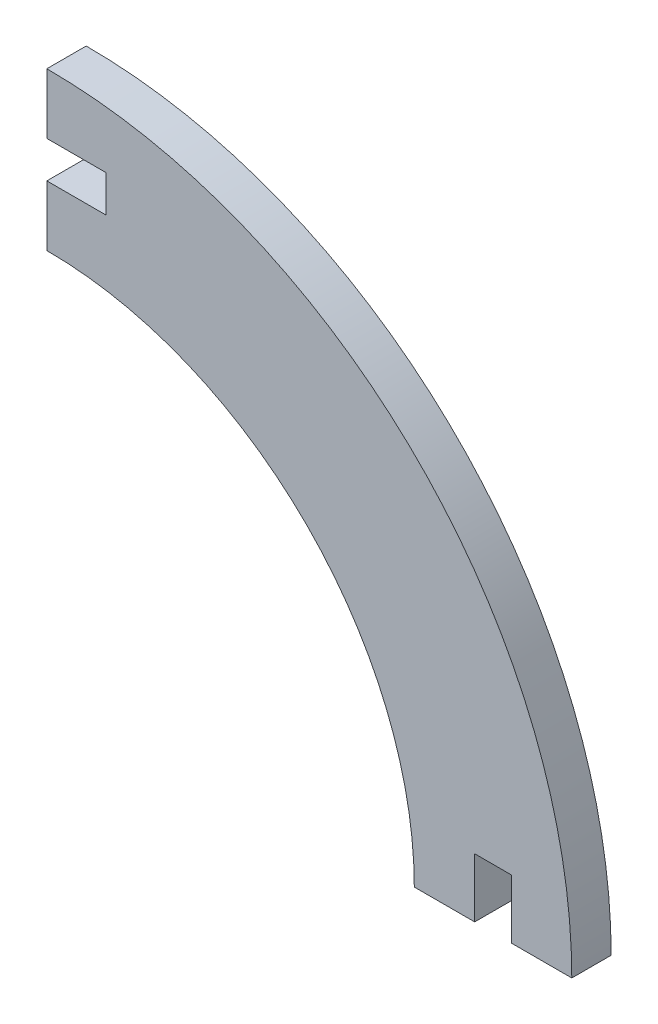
SolidWorks part; units mm, degrees
ref_plane "Plan de face" through (0, 0, 0) normal (0, 0, 1) x (1, 0, 0)
ref_plane "Plan de dessus" through (0, 0, 0) normal (0, 1, 0) x (1, 0, 0)
ref_plane "Plan de droite" through (0, 0, 0) normal (1, 0, 0) x (0, 0, -1)
sketch "Esquisse1" plane through (0, 0, 0) normal (0, 0, 1) x (1, 0, 0)
  line L15 (0, 28) -> (0, 32.6)
  line L16 (28, 0) -> (32.6, 0)
  line L17 (0, 35.4) -> (0, 40)
  line L18 (0, 35.4) -> (4.5, 35.4)
  line L20 (0, 32.6) -> (4.5, 32.6)
  line L21 (4.5, 35.4) -> (4.5, 32.6)
  line L22 (35.4, 0) -> (40, 0)
  line L23 (0, 40) -> (0, 28) construction
  line L24 (35.4, 4.5) -> (32.6, 4.5)
  line L25 (35.4, 4.5) -> (35.4, 0)
  line L27 (32.6, 4.5) -> (32.6, 0)
  arc A2 (0, 40) -> (40, 0) centre (0, 0) cw
  arc A3 (0, 28) -> (28, 0) centre (0, 0) cw
  point P7 (6.6406, 34)
  point P14 (34, 0)
extrude "Boss.-Extru.1" add sketch "Esquisse1" along normal blind 3
equation "\"thickness\"= 3"
equation "\"adjustement\"= 0.2"
equation "\"depth\" = \"thickness\" * 1.5"
equation "\"widht\"= \"thickness\" - \"adjustement\""
equation "\"D2@Esquisse1\"=\"widht\""
equation "\"D3@Esquisse1\"=\"widht\""
equation "\"D4@Esquisse1\"=\"depth\""
equation "\"D5@Esquisse1\"=\"depth\""
equation "\"D1@Boss.-Extru.1\"=\"thickness\""
